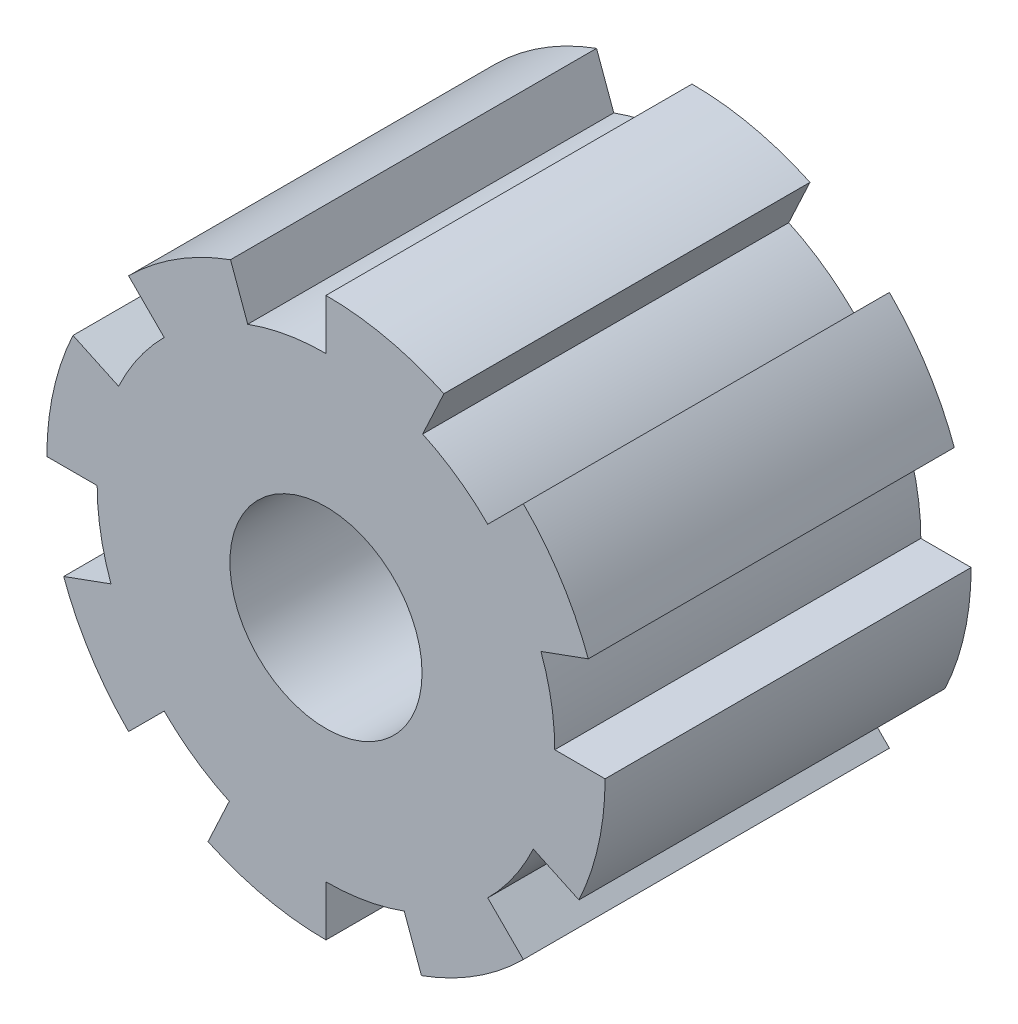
SolidWorks part; units mm, degrees
ref_plane "Plan de face" through (0, 0, 0) normal (0, 0, 1) x (1, 0, 0)
ref_plane "Plan de dessus" through (0, 0, 0) normal (0, 1, 0) x (1, 0, 0)
ref_plane "Plan de droite" through (0, 0, 0) normal (1, 0, 0) x (0, 0, -1)
sketch "Esquisse1" plane through (0, 0, 0) normal (0, 0, 1) x (1, 0, 0)
  circle A1 centre (0, 0) radius 5
  dimension "D2" = 10
extrude "Boss.-Extru.1" add sketch "Esquisse1" along normal blind 8
sketch "Esquisse2" plane through (0, 0, 8) normal (0, 0, 1) x (1, 0, 0)
  line L0 (0, 0) -> (-6.1, 0)
  line L1 (-5.5285, 2.578) -> (0, 0)
  arc A0 (-5.5285, 2.578) -> (-6.1, 0) centre (0, 0) ccw
  dimension "D1" = 12.2
  dimension "D2" = 25
extrude "Boss.-Extru.2" add sketch "Esquisse2" against normal up to surface (8 mm away)
pattern_circular "Répétition circulaire1" count 8 over 360 about axis through (0, 0, 0) along (0, 0, 1) of "Boss.-Extru.2"
hole_wizard "Trou taraudé M51" positions "Esquisse3" profile "Esquisse5" tap size "M5" standard "ISO"
sketch "Esquisse3" plane through (0, 0, 8) normal (0, 0, 1) x (1, 0, 0)
  point P0 (0, 0)
sketch "Esquisse5" plane through (0, 0, 8) normal (1, 0, 0) x (0, -1, 0)
  line L0 (0, 0) -> (0, 8)
  line L1 (0, 8) -> (2.1, 8)
  line L2 (2.1, 8) -> (2.1, 0)
  line L5 (2.1, 0) -> (0, 0)
  line L11 (0, -6.35) -> (0, 107.95) construction
  dimension "Diamètre du trou pour taraudage jusqu'au prochain" = 4.2
  dimension "Profondeur du trou pour taraudage jusqu'au prochain" = 8
